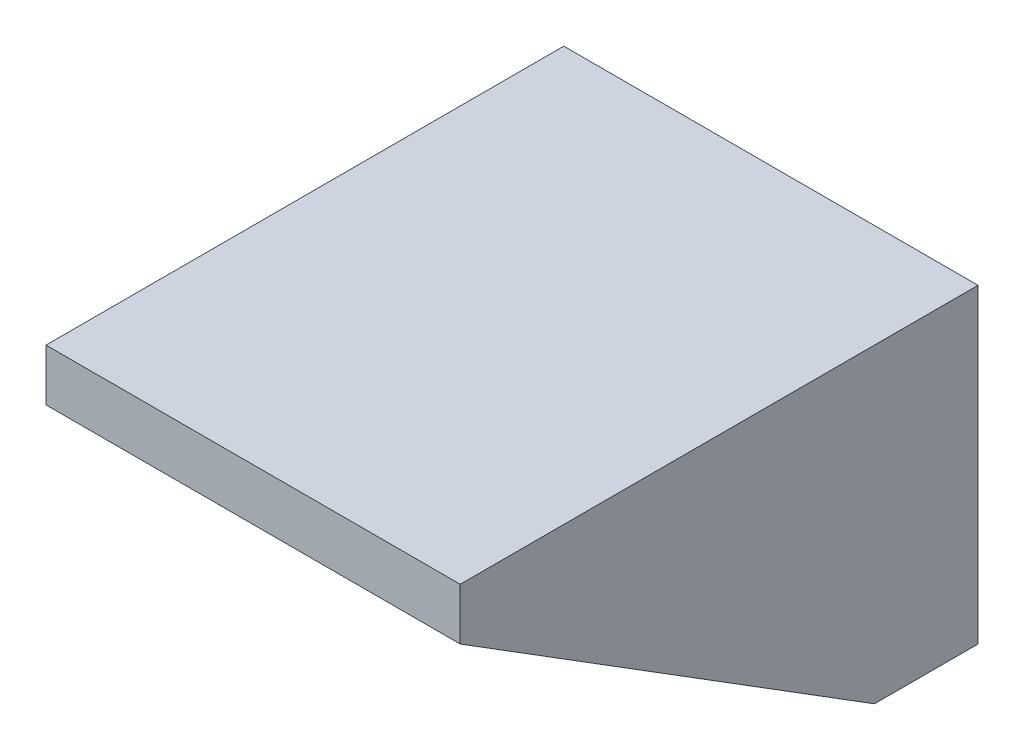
SolidWorks part; units mm, degrees
ref_plane "Plan de face" through (0, 0, 0) normal (0, 0, 1) x (1, 0, 0)
ref_plane "Plan de dessus" through (0, 0, 0) normal (0, 1, 0) x (1, 0, 0)
ref_plane "Plan de droite" through (0, 0, 0) normal (1, 0, 0) x (0, 0, -1)
sketch "Esquisse1" plane through (0, 0, 0) normal (0, 0, 1) x (1, 0, 0)
  line L1 (-40, 0) -> (40, 0)
  line L2 (-40, 0) -> (-40, -60)
  line L3 (-40, -60) -> (40, -60)
  line L4 (40, 0) -> (40, -60)
  dimension "D1" = 80
  dimension "D2" = 60
extrude "Extrusion1" add sketch "Esquisse1" along normal blind 20
sketch "Esquisse2" plane through (40, 0, 0) normal (1, 0, 0) x (0, 0, -1)
  line L0 (-20, -60) -> (-20, 0) construction
  line L1 (-20, -60) -> (-20, 0)
  line L2 (-20, 0) -> (-100, 0)
  line L3 (-100, 0) -> (-100, -10)
  line L4 (-100, -10) -> (-20, -60)
  dimension "D1" = 80
  dimension "D2" = 10
extrude "Extrusion2" add sketch "Esquisse2" against normal up to surface (80 mm away)
